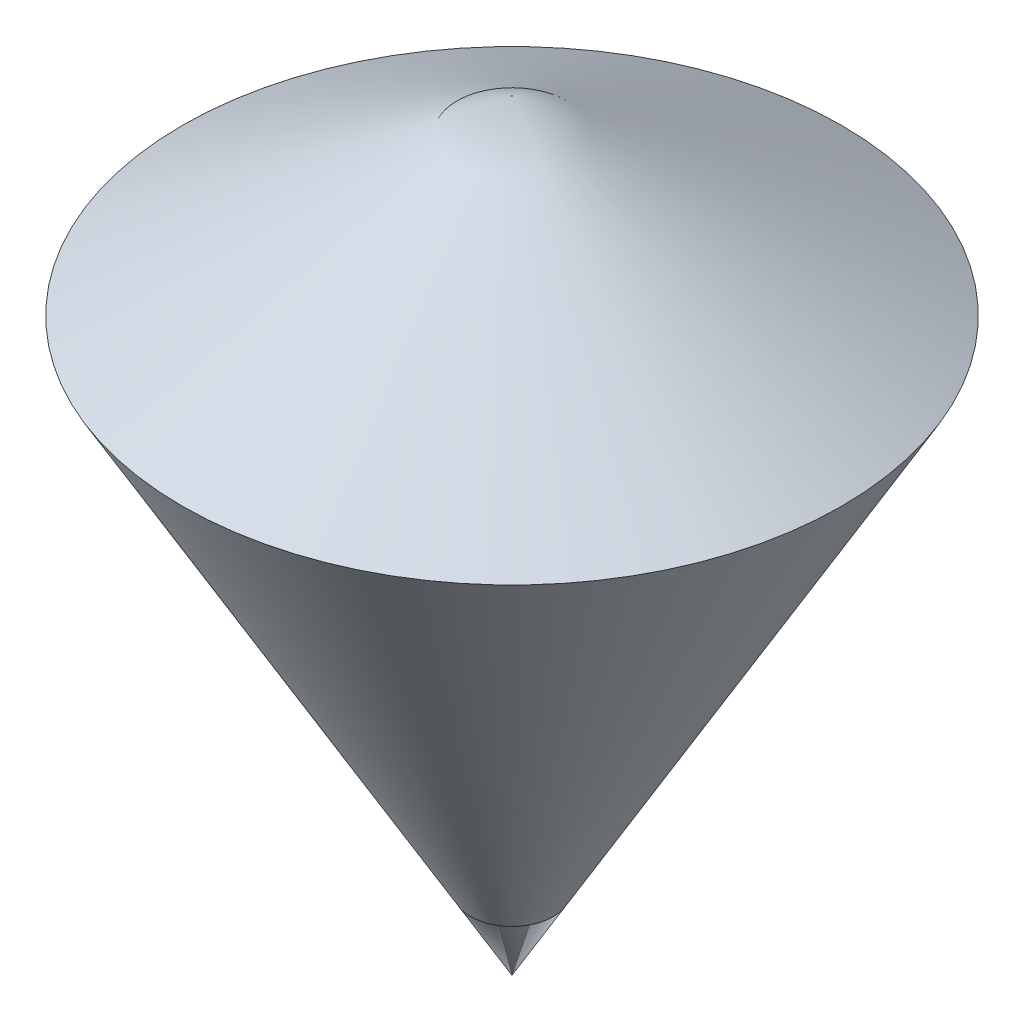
SolidWorks part; units mm, degrees
ref_plane "Front Plane" through (0, 0, 0) normal (0, 0, 1) x (1, 0, 0)
ref_plane "Top Plane" through (0, 0, 0) normal (0, 1, 0) x (1, 0, 0)
ref_plane "Right Plane" through (0, 0, 0) normal (1, 0, 0) x (0, 0, -1)
sketch "Sketch2" plane through (0, 0, 0) normal (0, 0, 1) x (1, 0, 0)
  line L0 (0, 0) -> (-17.3205, 30)
  line L1 (-17.3205, 30) -> (0, 40)
  line L2 (0, 40) -> (0, 0)
  dimension "D1" = 30
  dimension "D2" = 40
  dimension "D3" = 30
revolve "Revolve1" add sketch "Sketch2" angle 360 about L2
